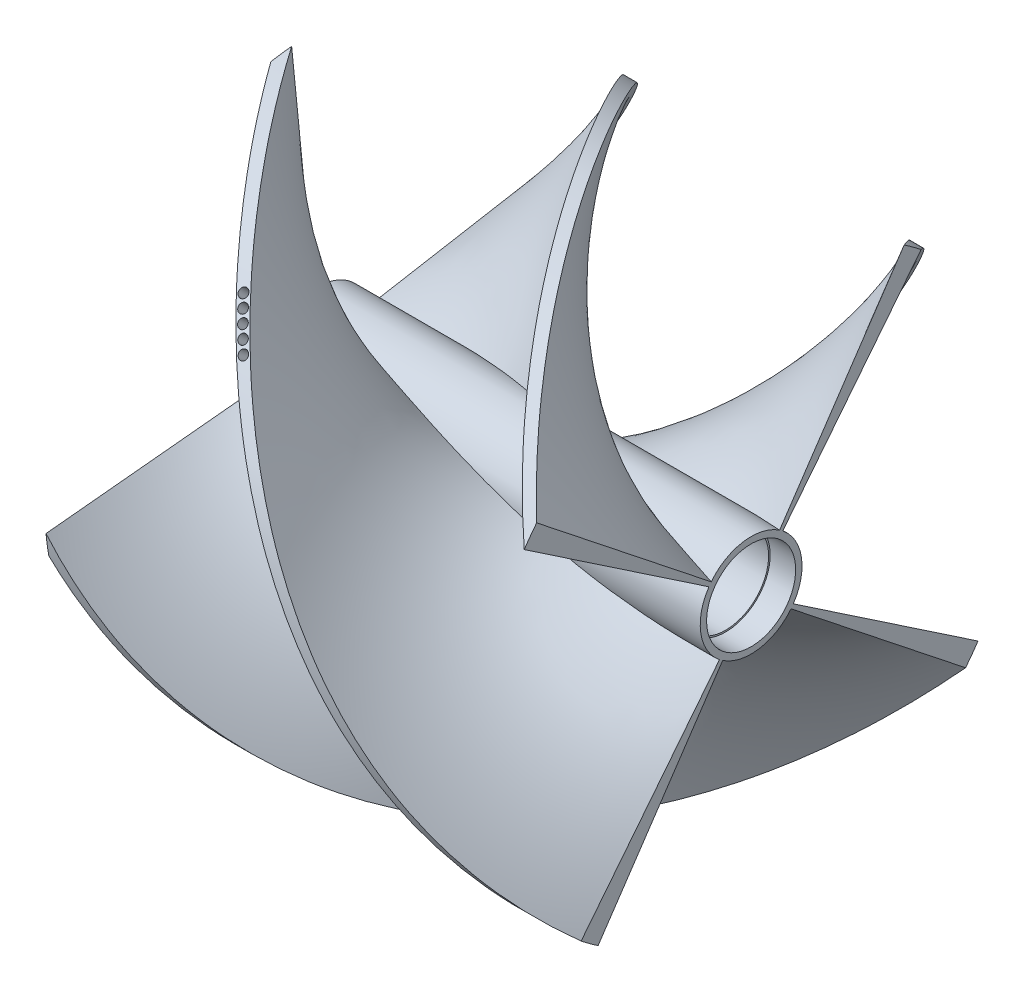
SolidWorks part; units mm, degrees
ref_plane "Plan de face" through (0, 0, 0) normal (0, 0, 1) x (1, 0, 0)
ref_plane "Plan de dessus" through (0, 0, 0) normal (0, 1, 0) x (1, 0, 0)
ref_plane "Plan de droite" through (0, 0, 0) normal (1, 0, 0) x (0, 0, -1)
imported_body "Importée1"
sketch "Esquisse1" plane through (0, 0, 0) normal (0, 0, 1) x (1, 0, 0)
  line L1 (58, 7) -> (64, 7)
  line L2 (58, 7) -> (58, 6.75)
  line L3 (58, 6.75) -> (64, 6.75)
  line L4 (64, 7) -> (64, 6.75)
  line L5 (-8.7384, 0) -> (89.9465, 0) construction
  line L7 (10, 7) -> (4, 7)
  line L8 (10, 7) -> (10, 6.75)
  line L9 (10, 6.75) -> (4, 6.75)
  line L10 (4, 7) -> (4, 6.75)
  dimension "D1" = 6
  dimension "D2" = 6
revolve "Révolution1" add sketch "Esquisse1" angle 360 about L5
